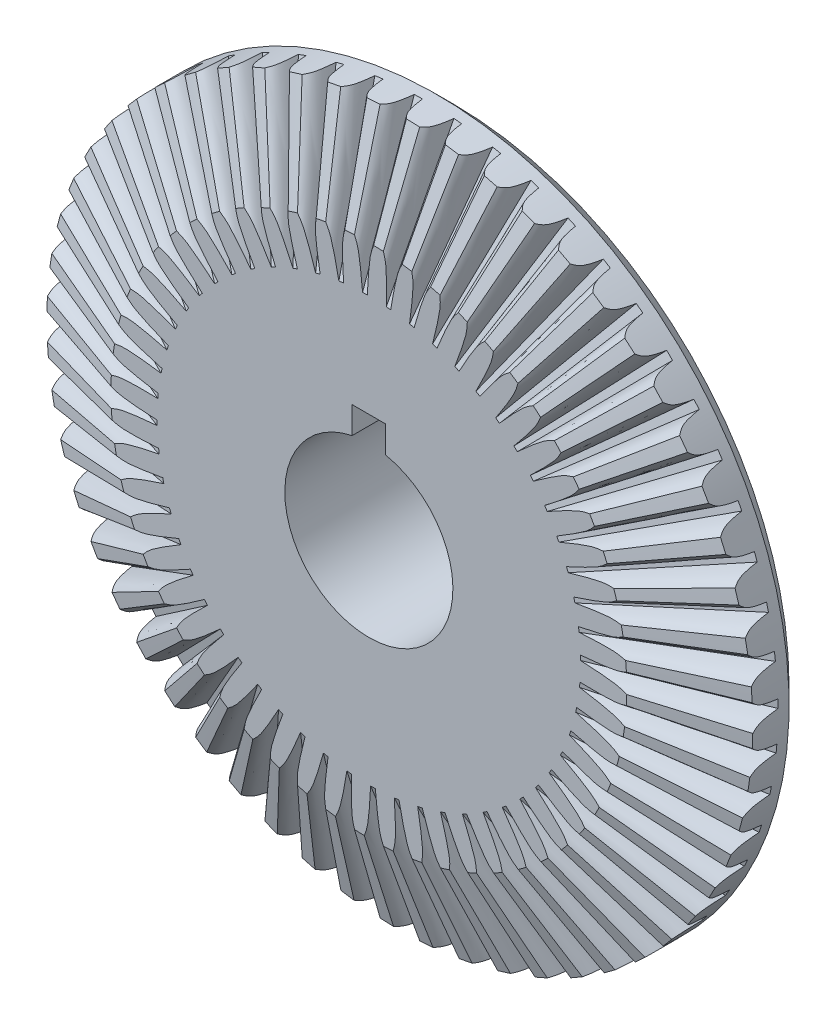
SolidWorks part; units mm, degrees
ref_plane "Plane1" through (0, 0, 0) normal (0, 0, 1) x (1, 0, 0)
ref_plane "Plane2" through (0, 0, 0) normal (0, 1, 0) x (1, 0, 0)
ref_plane "Plane3" through (0, 0, 0) normal (1, 0, 0) x (0, 0, -1)
sketch "Esquisse1" plane through (0, 0, 0) normal (0, 0, 1) x (1, 0, 0)
  line L0 (0, 0) -> (0, 29.6) construction
  line L1 (0, 0) -> (3.3727, 29.9171) construction
  line L2 (0, 0) -> (1.2627, 33.6977) construction
  line L3 (0, 0) -> (3.124, 29.564) construction
  line L4 (0, 0) -> (1.6675, 29.6761) construction
  line L5 (0, 0) -> (0.553, 29.6056) construction
  line L6 (0, 0) -> (-0.2012, 28.8134) construction
  line L7 (2.3812, 22.5345) -> (1.8536, 22.5841)
  line L8 (2.3812, 22.5345) -> (0, 0)
  line L9 (-0.1582, 22.6594) -> (0, 0)
  arc A0 (0.5158, 27.6152) -> (1.5524, 27.5763) centre (0, 0) cw
  point P13 (0, 25.2)
  point P14 (0.26, 26.78)
  point P15 (0.44, 27.38)
  point P18 (1.886, 25.1293)
  point P19 (1.7449, 26.7244)
  point P20 (1.6103, 27.3361)
  dimension "D4" = 6.432
  dimension "D5" = 3.216
  dimension "D6" = 178.93
  dimension "D7" = 178.93
  dimension "D8" = 179.6
  dimension "D9" = 179.6
ref_plane "Plan4" through (0, 0, 4) normal (0, 0, 1) x (1, 0, 0)
sketch "Esquisse2" plane through (0, 0, 4) normal (0, 0, 1) x (1, 0, 0)
  line L0 (0.4921, 13.1318) -> (0.548, 14.6233) construction
  line L1 (0, 0) -> (1.2627, 33.6977) construction
  line L2 (1.3184, 12.5308) -> (1.0376, 12.5572)
  line L3 (1.3184, 12.5308) -> (0, 0)
  line L4 (-0.0949, 12.5996) -> (0, 0)
  arc A0 (0.2848, 15.3424) -> (0.8642, 15.3206) centre (0, 0) cw
  point P6 (0, 14)
  point P7 (0.2, 15.12)
  point P14 (1.0478, 13.9607)
  point P15 (0.9321, 15.0926)
loft "Base-Lissage" add profiles "Esquisse2", "Esquisse1"
sketch "Esquisse3" plane through (0, 0, 0) normal (1, 0, 0) x (0, 0, -1)
  line L0 (3.38, 0) -> (-5.6, 0) construction
pattern_circular "Répétition circulaire1" count 56 every 6.43
sketch "Esquisse4" plane through (0, 0, 0) normal (0, 0, -1) x (-1, 0, 0)
  circle A0 centre (0, 0) radius 21
  circle A1 centre (0, 0) radius 30.158
  dimension "D1" = 42
extrude "Enlèv. mat.-Extru.1" cut sketch "Esquisse4" against normal blind 8
sketch "Esquisse5" plane through (0, 0, 4) normal (0, 0, 1) x (1, 0, 0)
  circle A0 centre (0, 0) radius 5
  dimension "D1" = 10
sketch "Esquisse6" plane through (0, 0, 0) normal (0, 0, -1) x (-1, 0, 0)
  circle A0 centre (0, 0) radius 21
  dimension "D1" = 42
extrude "Boss.-Extru.1" add sketch "Esquisse6" along normal blind 1
chamfer "Chanfrein1" distance 1 angle 45
sketch "Esquisse7" plane through (0, 0, -1) normal (0, 0, -1) x (-1, 0, 0)
  circle A0 centre (0, 0) radius 10
  dimension "D1" = 20
extrude "Boss.-Extru.2" add sketch "Esquisse7" along normal blind 3
sketch "Esquisse8" plane through (0, 0, -4) normal (0, 0, -1) x (-1, 0, 0)
  circle A0 centre (0, 0) radius 9
  dimension "D1" = 18
extrude "Boss.-Extru.3" add sketch "Esquisse8" along normal blind 2
sketch "Esquisse9" plane through (0, 0, -6) normal (0, 0, -1) x (-1, 0, 0)
  circle A0 centre (0, 0) radius 8
  dimension "D1" = 16
extrude "Boss.-Extru.4" add sketch "Esquisse9" along normal blind 2
extrude "Enlèv. mat.-Extru.2" cut sketch "Esquisse5" against normal through all
sketch "Esquisse10" plane through (0, 0, 4) normal (0, 0, 1) x (1, 0, 0)
  line L0 (-1, 6.5) -> (1, 6.5)
  line L1 (-1, 6.5) -> (-1, 4.527)
  line L2 (1, 4.527) -> (-1, 4.527)
  line L3 (1, 4.527) -> (1, 6.5)
  dimension "D1" = 1
  dimension "D2" = 2
  dimension "D3" = 6.5
extrude "Enlèv. mat.-Extru.3" cut sketch "Esquisse10" against normal through all
